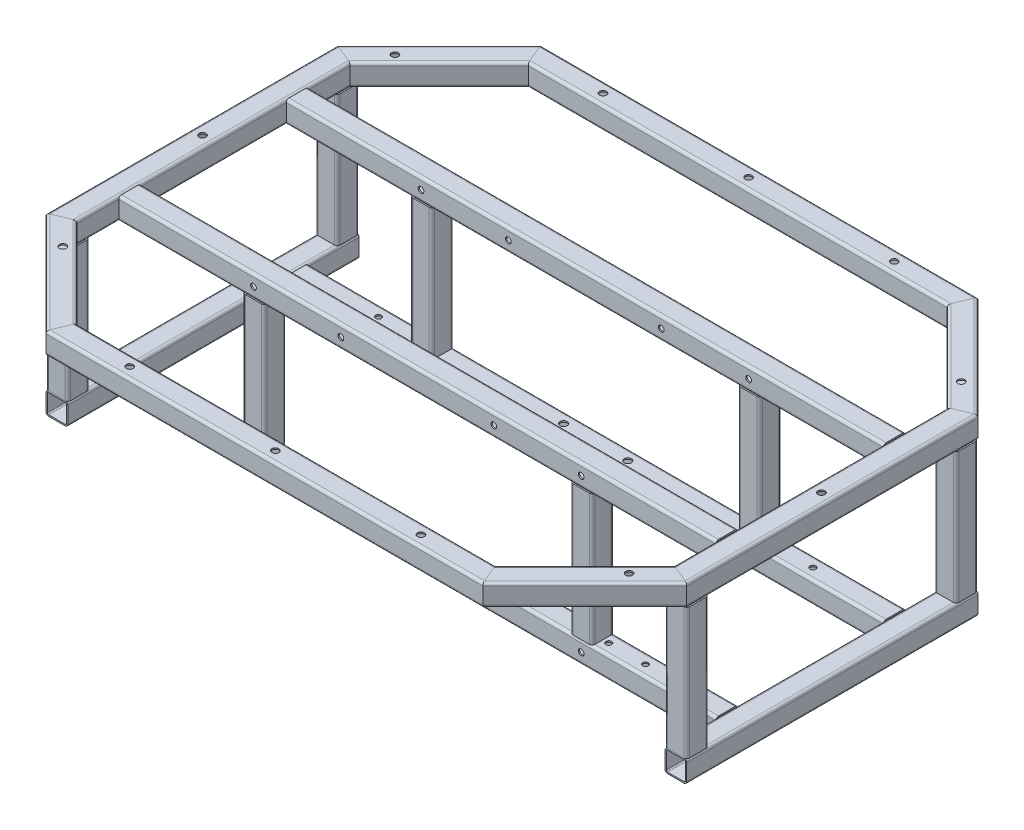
SolidWorks part; units mm, degrees
other "Marca1"
sketch "Croquis1"
other "Marca2"
sketch "Croquis2" [suppressed] plane through (279.4, 203.2, 215.9) normal (0.8898, 0.4543, 0.0428) x (0.048, 0, -0.9988)
ref_plane "Alzado" through (0, 0, 0) normal (0, 0, 1) x (1, 0, 0)
ref_plane "Planta" through (0, 0, 0) normal (0, 1, 0) x (1, 0, 0)
ref_plane "Vista lateral" through (0, 0, 0) normal (1, 0, 0) x (0, 0, -1)
sketch3d "Croquis3D1"
  line L0 (-279.4, 0, 0) -> (279.4, 0, 0) construction
  line L1 (0, 0, 215.9) -> (0, 0, -215.9) construction
  line L2 (0, 0, 0) -> (0, 152.4, 0) construction
  line L3 (-279.4, 0, 127) -> (-279.4, 0, -127)
  line L4 (-279.4, 0, -127) -> (-190.5, 0, -215.9) construction
  line L5 (-190.5, 0, -215.9) -> (190.5, 0, -215.9) construction
  line L6 (-279.4, 0, -127) -> (-279.4, 152.4, -127)
  line L7 (-114.3, 0, -215.9) -> (-114.3, 152.4, -215.9) construction
  line L8 (-190.5, 0, -215.9) -> (-190.5, 152.4, -215.9) construction
  line L9 (-190.5, 0, -215.9) -> (-279.4, 0, -215.9) construction
  line L10 (-279.4, 0, -215.9) -> (-279.4, 0, -127) construction
  line L11 (-190.5, 0, -215.9) -> (-114.3, 0, -215.9) construction
  line L12 (-114.3, 0, -215.9) -> (-63.5, 0, -190.5) construction
  line L13 (-63.5, 0, -190.5) -> (63.5, 0, -190.5) construction
  line L14 (-190.5, 152.4, -215.9) -> (-279.4, 152.4, -127)
  line L15 (-279.4, 0, 215.9) -> (-279.4, 0, 127) construction
  line L16 (-190.5, 0, 215.9) -> (-279.4, 0, 215.9) construction
  line L17 (-190.5, 0, 215.9) -> (190.5, 0, 215.9) construction
  line L18 (-114.3, 0, 215.9) -> (-114.3, 152.4, 215.9) construction
  line L19 (-190.5, 0, 215.9) -> (-114.3, 0, 215.9)
  line L20 (-114.3, 0, 215.9) -> (-63.5, 0, 190.5) construction
  line L21 (-279.4, 0, 127) -> (-190.5, 0, 215.9) construction
  line L22 (-190.5, 0, 215.9) -> (-190.5, 152.4, 215.9) construction
  line L23 (-190.5, 152.4, 215.9) -> (-279.4, 152.4, 127)
  line L24 (-279.4, 0, 127) -> (-279.4, 152.4, 127)
  line L25 (190.5, 0, 215.9) -> (279.4, 0, 215.9) construction
  line L26 (279.4, 0, -215.9) -> (279.4, 0, -127) construction
  line L27 (190.5, 0, -215.9) -> (279.4, 0, -215.9) construction
  line L28 (279.4, 0, 127) -> (279.4, 152.4, 127)
  line L29 (190.5, 152.4, 215.9) -> (279.4, 152.4, 127)
  line L30 (190.5, 0, 215.9) -> (190.5, 152.4, 215.9) construction
  line L31 (279.4, 0, 127) -> (190.5, 0, 215.9) construction
  line L32 (114.3, 0, 215.9) -> (63.5, 0, 190.5) construction
  line L33 (190.5, 0, 215.9) -> (114.3, 0, 215.9) construction
  line L34 (114.3, 0, 215.9) -> (114.3, 152.4, 215.9) construction
  line L35 (114.3, 0, -215.9) -> (63.5, 0, -190.5) construction
  line L36 (190.5, 0, -215.9) -> (114.3, 0, -215.9)
  line L37 (190.5, 0, -215.9) -> (190.5, 152.4, -215.9) construction
  line L38 (114.3, 0, -215.9) -> (114.3, 152.4, -215.9) construction
  line L39 (279.4, 0, -127) -> (279.4, 152.4, -127)
  line L40 (279.4, 0, -127) -> (190.5, 0, -215.9) construction
  line L41 (279.4, 0, 127) -> (279.4, 0, -127)
  line L42 (-63.5, 0, 190.5) -> (63.5, 0, 190.5) construction
  line L43 (-190.5, 152.4, -215.9) -> (-114.3, 152.4, -215.9) construction
  line L44 (114.3, 152.4, -215.9) -> (190.5, 152.4, -215.9)
  line L45 (279.4, 152.4, -127) -> (190.5, 152.4, -215.9)
  line L46 (190.5, 152.4, 215.9) -> (114.3, 152.4, 215.9)
  line L47 (-114.3, 152.4, 215.9) -> (-190.5, 152.4, 215.9)
  line L48 (-279.4, 152.4, -127) -> (-279.4, 152.4, 127)
  line L49 (279.4, 152.4, 127) -> (279.4, 152.4, -127)
  line L52 (-279.4, 0, 127) -> (279.4, 0, 127) construction
  line L53 (279.4, 0, -127) -> (-279.4, 0, -127) construction
  line L54 (279.4, 0, 215.9) -> (279.4, 0, 127) construction
  line L55 (-152.4, 0, 215.9) -> (-152.4, 152.4, 215.9) construction
  line L57 (152.4, 0, 215.9) -> (152.4, 152.4, 215.9) construction
  line L59 (152.4, 0, -215.9) -> (152.4, 152.4, -215.9) construction
  line L60 (-152.4, 0, -215.9) -> (-152.4, 152.4, -215.9) construction
  line L63 (0, 0, -190.5) -> (0, 0, -127) construction
  line L64 (-190.5, 0, -215.9) -> (-190.5, 0, 215.9) construction
  line L65 (-190.5, 0, -215.9) -> (-190.5, 0, -63.5) construction
  line L66 (-190.5, 0, 127) -> (-279.4, 0, 127) construction
  line L67 (0, 0, 0) -> (0, 0, 190.5) construction
  line L68 (0, 0, -127) -> (0, 0, 0) construction
  line L69 (-190.5, 0, 215.9) -> (-190.5, 0, 63.5) construction
  line L70 (190.5, 0, 215.9) -> (190.5, 0, 63.5) construction
  line L71 (190.5, 0, 127) -> (279.4, 0, 127) construction
  line L72 (0, 0, -190.5) -> (0, 0, -127) construction
  line L73 (0, 0, 190.5) -> (0, 0, 127)
  line L74 (190.5, 0, -127) -> (279.4, 0, -127) construction
  line L75 (190.5, 0, -215.9) -> (190.5, 0, -63.5) construction
  line L76 (-190.5, 0, 190.5) -> (190.5, 0, 190.5) construction
  line L77 (-190.5, 152.4, -215.9) -> (190.5, 152.4, -215.9)
  line L78 (-190.5, 152.4, 215.9) -> (190.5, 152.4, 215.9)
  line L79 (-190.5, 0, -190.5) -> (190.5, 0, -190.5) construction
  line L80 (279.4, 152.4, -63.5) -> (-279.4, 152.4, -63.5)
  line L81 (279.4, 152.4, 63.5) -> (-279.4, 152.4, 63.5)
  line L82 (279.4, 0, -63.5) -> (-279.4, 0, -63.5) construction
  line L83 (279.4, 0, 63.5) -> (-279.4, 0, 63.5) construction
  line L84 (-279.4, 0, 63.5) -> (279.4, 0, 63.5)
  line L85 (-279.4, 0, -63.5) -> (279.4, 0, -63.5)
  line L86 (152.4, 0, -63.5) -> (152.4, 152.4, -63.5)
  line L87 (-190.5, 0, -127) -> (-279.4, 0, -127) construction
  line L88 (-190.5, 0, 127) -> (-279.4, 0, 127) construction
  line L89 (152.4, 0, 63.5) -> (152.4, 152.4, 63.5)
  line L90 (-152.4, 0, -63.5) -> (-152.4, 152.4, -63.5)
  line L91 (-152.4, 0, 63.5) -> (-152.4, 152.4, 63.5)
  point P4 (0, 0, 0)
  point P8 (0, 0, 0)
  point P20 (-152.4, 0, -215.9)
  point P26 (-152.4, 0, 215.9)
  point P42 (0, 0, -190.5)
  point P46 (152.4, 0, 215.9)
  point P70 (0, 0, 190.5)
  dimension "D1" = 431.8
  dimension "D2" = 558.8
  dimension "D3" = 152.4
  dimension "D4" = 45
  dimension "D5" = 254
  dimension "D6" = 127
  dimension "D7" = 228.6
  dimension "D8" = 25.4
  dimension "D9" = 152.4
  dimension "D10" = 127
other " C:\\PROGRAM FILES\\SOLIDWORKS CORP\\SOLIDWORKS\\DATA\\WELDMENT PROFILES\\ACEROS_MURILLO\\CADB - FALTA(1)"
ref_plane "Plano1" through (269.875, 9.525, 127) normal (0, 0, -1) x (1, 0, 0)
sketch "Sketch12" plane through (269.875, 9.525, 127) normal (0, 0, -1) x (1, 0, 0)
  line L1 (-7.1628, -9.525) -> (7.1628, -9.525)
  line L2 (-9.525, -7.1628) -> (-9.525, 7.1628)
  line L3 (-7.1628, 9.525) -> (7.1628, 9.525)
  line L4 (9.525, -7.1628) -> (9.525, 7.1628)
  line L5 (-9.525, -9.525) -> (9.525, 9.525) construction
  line L6 (-9.525, 9.525) -> (9.525, -9.525) construction
  line L7 (-7.1628, -8.3312) -> (7.1628, -8.3312)
  line L8 (-8.3312, -7.1628) -> (-8.3312, 7.1628)
  line L9 (-7.1628, 8.3312) -> (7.1628, 8.3312)
  line L10 (8.3312, -7.1628) -> (8.3312, 7.1628)
  line L11 (-8.3312, -8.3312) -> (8.3312, 8.3312) construction
  line L12 (-8.3312, 8.3312) -> (8.3312, -8.3312) construction
  arc A0 (-7.1628, -9.525) -> (-9.525, -7.1628) centre (-7.1628, -7.1628) cw
  arc A1 (7.1628, -9.525) -> (9.525, -7.1628) centre (7.1628, -7.1628) ccw
  arc A2 (7.1628, 9.525) -> (9.525, 7.1628) centre (7.1628, 7.1628) cw
  arc A3 (-9.525, 7.1628) -> (-7.1628, 9.525) centre (-7.1628, 7.1628) cw
  arc A4 (-7.1628, -8.3312) -> (-8.3312, -7.1628) centre (-7.1628, -7.1628) cw
  arc A5 (7.1628, -8.3312) -> (8.3312, -7.1628) centre (7.1628, -7.1628) ccw
  arc A6 (7.1628, 8.3312) -> (8.3312, 7.1628) centre (7.1628, 7.1628) cw
  arc A7 (-8.3312, 7.1628) -> (-7.1628, 8.3312) centre (-7.1628, 7.1628) cw
  point P0 (0, 0)
  point P6 (0, 0)
  point P11 (0, -9.525)
  point P12 (9.525, 0)
  point P13 (0, 9.525)
  point P14 (-9.525, 0)
  point P39 (0, 0)
  dimension "Round" = 2.3622
  dimension "Espesors" = 1.1938
  dimension "LArgo" = 19.05
sketch "Sketch13" plane through (0, 19.05, 0) normal (0, 1, 0) x (1, 0, 0)
  line L0 (28, 73.025) -> (-28, 73.025) construction
  line L1 (0, 0) -> (38.1409, 0) construction
  line L2 (0, 82.55) -> (0, 63.5) construction
  line L3 (-260.35, 82.55) -> (260.35, 82.55) construction
  line L4 (-260.35, 63.5) -> (260.35, 63.5) construction
  line L5 (28, 206.375) -> (-28, 206.375) construction
  line L6 (0, 215.9) -> (0, 196.85) construction
  line L7 (-182.6092, 196.85) -> (182.6092, 196.85) construction
  line L8 (-190.5, 215.9) -> (190.5, 215.9) construction
  circle A0 centre (28, 73.025) radius 3.175
  circle A1 centre (-28, 73.025) radius 3.175
  circle A2 centre (-28, -73.025) radius 3.175
  circle A3 centre (28, -73.025) radius 3.175
  circle A4 centre (28, 206.375) radius 3.175
  circle A5 centre (-28, 206.375) radius 3.175
  circle A6 centre (-28, -206.375) radius 3.175
  circle A7 centre (28, -206.375) radius 3.175
  point P4 (0, 73.025)
  point P19 (0, 73.025)
  point P25 (0, 206.375)
  point P28 (0, 206.375)
  dimension "D1" = 6.35
  dimension "D2" = 56
extrude "Cut-Extrude1" cut sketch "Sketch13" against normal through all
sketch "Sketch14" plane through (0, 0, 82.55) normal (0, 0, 1) x (1, 0, 0)
  line L1 (-152.4, 152.4) -> (152.4, 152.4) construction
  line L2 (-152.4, 152.4) -> (-152.4, 0) construction
  line L3 (-152.4, 0) -> (152.4, 0) construction
  line L4 (152.4, 152.4) -> (152.4, 0) construction
  line L5 (-152.4, 152.4) -> (152.4, 0) construction
  line L6 (-152.4, 0) -> (152.4, 152.4) construction
  line L7 (189.5215, 152.4) -> (-189.5215, 152.4) construction
  line L8 (152.4, 133.35) -> (152.4, 19.05) construction
  line L9 (0, 76.2) -> (0, 0) construction
  line L10 (0, 76.2) -> (152.4, 76.2) construction
  line L11 (-142.875, 142.875) -> (-66.675, 142.875) construction
  line L12 (260.35, 0) -> (-260.35, 0) construction
  circle A0 centre (-142.875, 142.875) radius 2.5
  circle A1 centre (-66.675, 142.875) radius 2.5
  circle A2 centre (142.875, 142.875) radius 2.5
  circle A3 centre (66.675, 142.875) radius 2.5
  circle A4 centre (142.875, 9.525) radius 2.5
  circle A5 centre (66.675, 9.525) radius 2.5
  circle A6 centre (-142.875, 9.525) radius 2.5
  circle A7 centre (-66.675, 9.525) radius 2.5
  point P0 (0, 76.2)
  dimension "D2" = 5
  dimension "D1" = 9.525
  dimension "D3" = 9.525
  dimension "D5" = 76.2
  dimension "D4" = 2
extrude "Cut-Extrude2" cut sketch "Sketch14" against normal up to surface (165.1 mm away)
sketch "Sketch15" plane through (0, 152.4, 0) normal (0, 1, 0) x (1, 0, 0)
  line L0 (0, 0) -> (0, -206.375) construction
  line L9 (219.075, 206.375) -> (-219.075, 206.375) construction
  line L10 (219.075, 206.375) -> (219.075, -206.375) construction
  line L11 (219.075, -206.375) -> (-219.075, -206.375) construction
  line L14 (-219.075, 206.375) -> (-219.075, -206.375) construction
  line L16 (219.075, 206.375) -> (-219.075, -206.375) construction
  line L17 (219.075, -206.375) -> (-219.075, 206.375) construction
  line L18 (0, 0) -> (219.075, 0) construction
  line L19 (-228.6, -177.8) -> (-228.6, 177.8) construction
  line L20 (-228.6, 177.8) -> (-279.4, 127) construction
  line L21 (-279.4, 127) -> (-279.4, -127) construction
  line L22 (-279.4, -127) -> (-228.6, -177.8) construction
  line L23 (-279.4, -127) -> (-279.4, 127) construction
  line L24 (-190.5, -215.9) -> (-279.4, -127) construction
  line L25 (-277.0378, -126.0215) -> (-262.7122, -120.0877) construction
  line L26 (-269.875, 123.0546) -> (-269.875, -123.0546) construction
  line L27 (-277.0378, 126.0215) -> (-262.7122, 120.0877) construction
  line L30 (-279.4, 127) -> (-190.5, 215.9) construction
  circle A10 centre (0, -206.375) radius 3
  circle A11 centre (127, -206.375) radius 3
  circle A12 centre (-127, -206.375) radius 3
  circle A13 centre (0, 206.375) radius 3
  circle A14 centre (127, 206.375) radius 3
  circle A15 centre (-127, 206.375) radius 3
  circle A16 centre (-269.875, 0) radius 3
  circle A17 centre (-246.9289, -144.8289) radius 3
  circle A20 centre (269.875, 0) radius 3
  circle A22 centre (-246.9289, 144.8289) radius 3
  circle A23 centre (246.9289, 144.8289) radius 3
  circle A24 centre (246.9289, -144.8289) radius 3
  point P0 (0, 0)
  point P31 (-228.6, 0)
  dimension "D5" = 6
  dimension "D3" = 6
  dimension "D1" = 438.15
  dimension "D2" = 412.75
  dimension "D4" = 127
  dimension "D6" = 50.8
  dimension "D7" = 10.3536
extrude "Cut-Extrude3" cut sketch "Sketch15" against normal up to next
sketch "Croquis5" plane through (0, 19.05, 0) normal (0, 1, 0) x (1, 0, 0)
  line L0 (0, 0) -> (0, 146.03) construction
  line L1 (-152.4, 65.8622) -> (-152.4, 80.1878) construction
  line L2 (-157.4, 73.025) -> (-189.4, 73.025) construction
  line L3 (-173.4, 63.5) -> (-173.4, 82.55) construction
  line L4 (-260.35, 63.5) -> (260.35, 63.5) construction
  line L5 (-260.35, 82.55) -> (260.35, 82.55) construction
  circle A0 centre (-157.4, 73.025) radius 2.5
  circle A1 centre (-189.4, 73.025) radius 2.5
  point P13 (-173.4, 73.025)
  point P14 (-173.4, 73.025)
  dimension "D1" = 5
  dimension "D2" = 5
  dimension "D3" = 32
  dimension "D4" = 32
extrude "Cortar-Extruir2" cut sketch "Croquis5" against normal through all
mirror "Simetría1" about plane through (0, 0, 0) normal (1, 0, 0) of "Cortar-Extruir2"
mirror "Simetría2" about plane through (0, 0, 0) normal (0, 0, 1) of "Simetría1", "Cortar-Extruir2"
